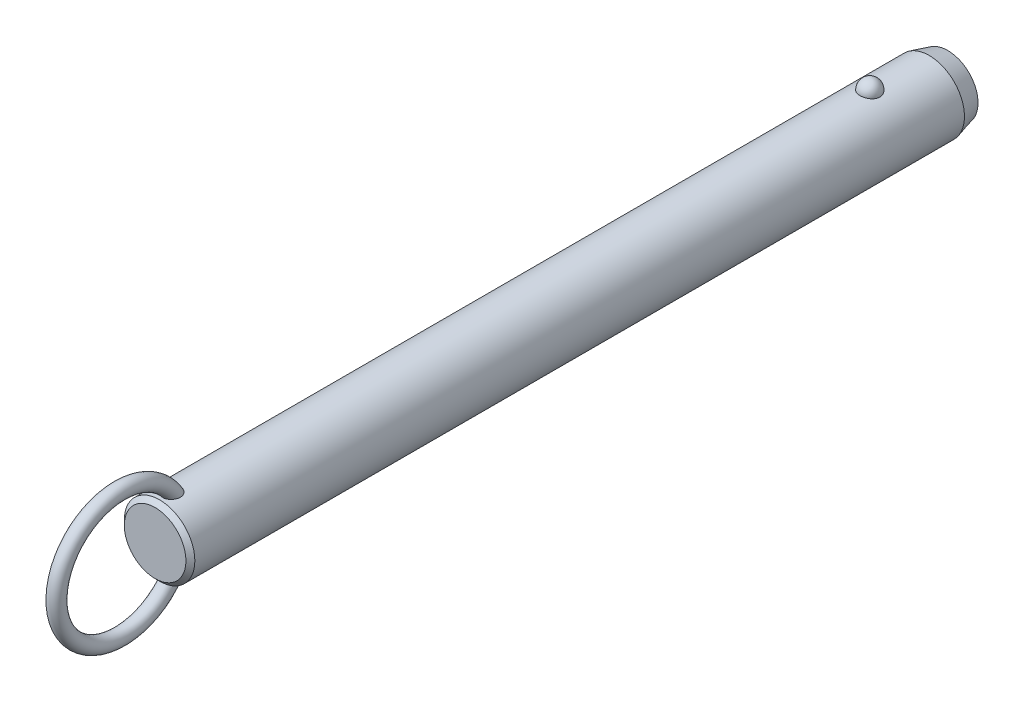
SolidWorks part; units mm, degrees
ref_plane "Front Plane" through (0, 0, 0) normal (0, 0, 1) x (1, 0, 0)
ref_plane "Top Plane" through (0, 0, 0) normal (0, 1, 0) x (1, 0, 0)
ref_plane "Right Plane" through (0, 0, 0) normal (1, 0, 0) x (0, 0, -1)
sketch "Sketch2" plane through (0, 0, 0) normal (0, 0, 1) x (1, 0, 0)
  circle A0 centre (0, 0) radius 9.5
  point P3 (0, 9.5)
  dimension "D1" = 19
extrude "Boss-Extrude1" add sketch "Sketch2" along normal blind 180.3
sketch "Sketch3" plane through (0, 0, 0) normal (0, 0, -1) x (-1, 0, 0)
  circle A0 centre (0, 0) radius 9.5
  dimension "D1" = 19
extrude "Boss-Extrude2" add sketch "Sketch3" along normal blind 23.7
chamfer "Chamfer1" distance 5 angle 15 1 edges at (-9.5, 0, -23.7)
sketch "Sketch12" plane through (0, 0, 0) normal (1, 0, 0) x (0, 0, -1)
  line L0 (-180.3, 9.5) -> (-180.3, -9.5) construction
  point P0 (-180.3, 0)
sketch "Sketch13" plane through (0, 0, 0) normal (1, 0, 0) x (0, 0, -1)
  circle A0 centre (-199.35, 0) radius 19.05
  point P2 (-180.3, 0)
  dimension "D1" = 38.1
sketch "Sketch14" plane through (0, 0, 0) normal (0, 1, 0) x (1, 0, 0)
  circle A0 centre (0, -182.3) radius 2
  point P2 (0, -180.3)
  dimension "D1" = 4
sweep "Sweep1" add profiles "Sketch14" path "Sketch13"
sketch "Sketch15" plane through (0, 0, 180.3) normal (0, 0, 1) x (1, 0, 0)
  circle A0 centre (0, 0) radius 9.5
  dimension "D1" = 19
extrude "Boss-Extrude3" add sketch "Sketch15" along normal blind 9.52
chamfer "Chamfer2" distance 1.2 angle 45 1 edges at (9.5, 0, 189.82)
sketch "Sketch18" plane through (0, 0, 0) normal (1, 0, 0) x (0, 0, -1)
  line L0 (18.7, 9.5) -> (-182.8378, 9.5) construction
  line L1 (2.7, 12.2) -> (2.7, 6.8)
  line L2 (-182.8378, -9.5) -> (18.7, -9.5) construction
  arc A0 (2.7, 12.2) -> (2.7, 6.8) centre (2.7, 9.5) ccw
  point P4 (0, 9.5)
  dimension "D1" = 21.7
revolve "Revolve1" add sketch "Sketch18" angle 360 about L1
